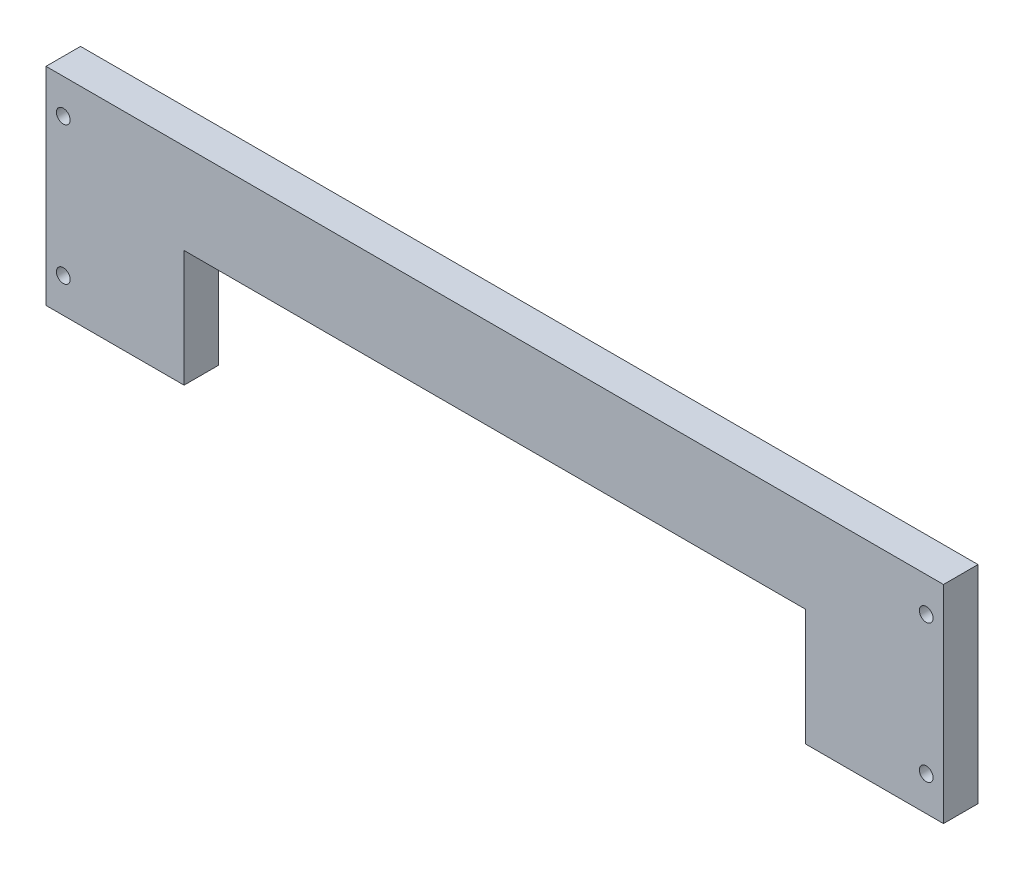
SolidWorks part; units mm, degrees
ref_plane "Front Plane" through (0, 0, 0) normal (0, 0, 1) x (1, 0, 0)
ref_plane "Top Plane" through (0, 0, 0) normal (0, 1, 0) x (1, 0, 0)
ref_plane "Right Plane" through (0, 0, 0) normal (1, 0, 0) x (0, 0, -1)
sketch "Sketch1" plane through (0, 0, 0) normal (0, 0, 1) x (1, 0, 0)
  line L1 (-76.4671, 31.211) -> (253.7329, 31.211)
  line L2 (-76.4671, 31.211) -> (-76.4671, -44.989)
  line L3 (-76.4671, -44.989) -> (253.7329, -44.989)
  line L4 (253.7329, 31.211) -> (253.7329, -44.989)
extrude "Boss-Extrude1" add sketch "Sketch1" along normal blind 12.7 contours L1 L4 L3 L2
sketch "Sketch3" plane through (0, 0, 0) normal (0, 0, -1) x (-1, 0, 0)
  line L0 (76.4671, -44.989) -> (-253.7329, -44.989) construction
  line L1 (-202.9329, -44.989) -> (25.6671, -44.989)
  line L2 (-202.9329, -44.989) -> (-202.9329, -2.063)
  line L3 (-202.9329, -2.063) -> (25.6671, -2.063)
  line L4 (25.6671, -44.989) -> (25.6671, -2.063)
  line L5 (-253.7329, 31.211) -> (-253.7329, -44.989) construction
  line L6 (76.4671, 31.211) -> (76.4671, -44.989) construction
  dimension "D1" = 50.8
  dimension "D2" = 50.8
extrude "Cut-Extrude1" cut sketch "Sketch3" against normal blind 12.7
hole_wizard "#8 (0.199) Diameter Hole1" positions "Sketch4" profile "Sketch5" hole size "#8" standard "ANSI Inch"
sketch "Sketch4" plane through (0, 0, 0) normal (0, 0, -1) x (-1, 0, 0)
  line L0 (76.4671, 31.211) -> (-253.7329, 31.211) construction
  line L1 (-253.7329, 31.211) -> (-253.7329, -44.989) construction
  line L2 (-202.9329, -44.989) -> (-253.7329, -44.989) construction
  line L3 (76.4671, 31.211) -> (76.4671, -44.989) construction
  line L4 (76.4671, -44.989) -> (25.6671, -44.989) construction
  point P0 (-247.3829, 18.511)
  point P2 (-247.3829, -32.289)
  point P4 (70.1171, 18.511)
  point P6 (70.1171, -32.289)
  dimension "D1" = 12.7
  dimension "D2" = 6.35
  dimension "D3" = 6.35
  dimension "D4" = 12.7
  dimension "D5" = 12.7
  dimension "D6" = 6.35
  dimension "D7" = 6.35
  dimension "D8" = 12.7
sketch "Sketch5" plane through (247.3829, 18.511, 0) normal (1, 0, 0) x (0, 1, 0)
  line L0 (0, 0) -> (0, 12.7)
  line L1 (0, 12.7) -> (2.5273, 12.7)
  line L2 (2.5273, 12.7) -> (2.5273, 2.0765)
  line L3 (2.5273, 2.0765) -> (4.6037, 0)
  line L5 (4.6037, 0) -> (0, 0)
  line L6 (-2.5273, 2.0765) -> (-4.6037, 0) construction
  line L11 (0, -6.35) -> (0, 107.95) construction
  dimension "Thru Hole Dia." = 5.0546
  dimension "Thru Hole Depth" = 12.7
  dimension "Near C'Sink Dia." = 9.2075
  dimension "Near C'Sink Angle" = 90
